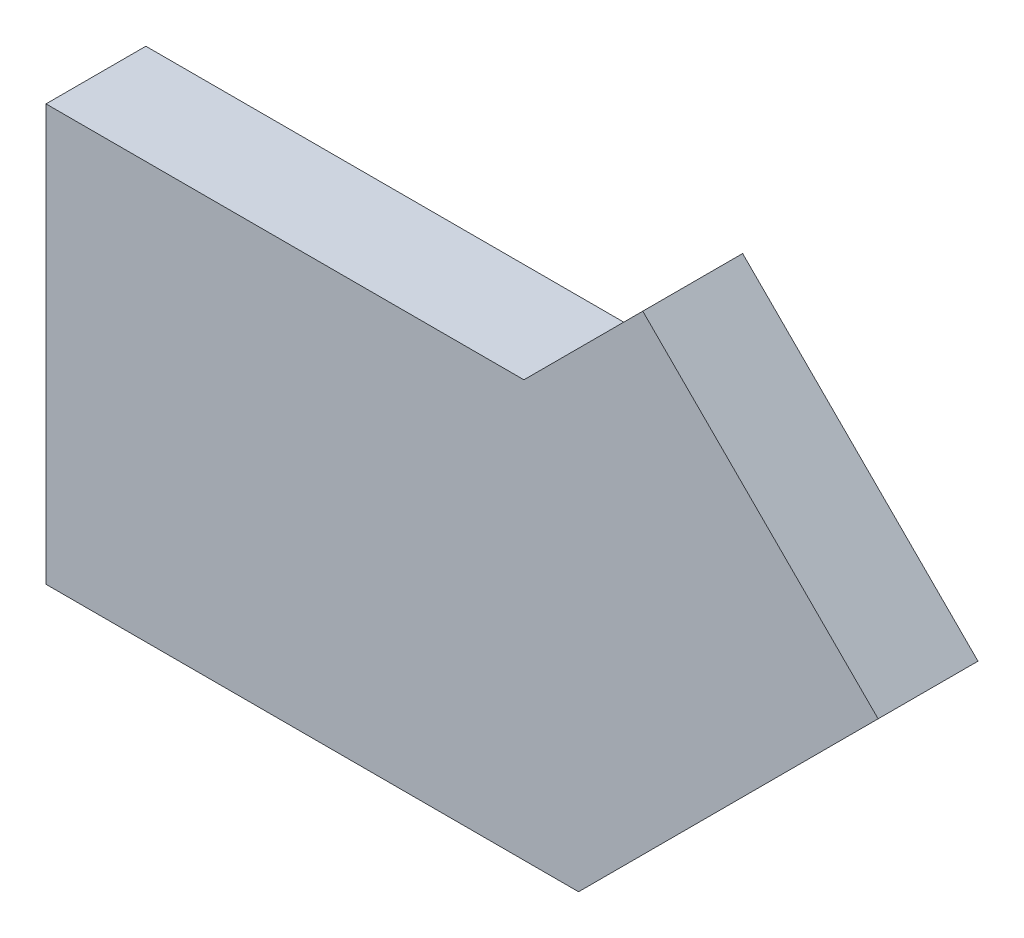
SolidWorks part; units mm, degrees
ref_plane "Front Plane" through (0, 0, 0) normal (0, 0, 1) x (1, 0, 0)
ref_plane "Top Plane" through (0, 0, 0) normal (0, 1, 0) x (1, 0, 0)
ref_plane "Right Plane" through (0, 0, 0) normal (1, 0, 0) x (0, 0, -1)
sketch "Sketch1" plane through (0, 0, 0) normal (0, 0, 1) x (1, 0, 0)
  line L0 (0, 0) -> (32, 0)
  line L1 (32, 0) -> (50, 18)
  line L2 (50, 18) -> (35.8579, 32.1421)
  line L3 (35.8579, 32.1421) -> (28.7157, 25)
  line L4 (28.7157, 25) -> (0, 25)
  line L5 (0, 25) -> (0, 0)
  dimension "D1" = 20
  dimension "D2" = 32
  dimension "D3" = 50
  dimension "D4" = 25
  dimension "D5" = 135
extrude "Boss-Extrude1" add sketch "Sketch1" along normal blind 6
